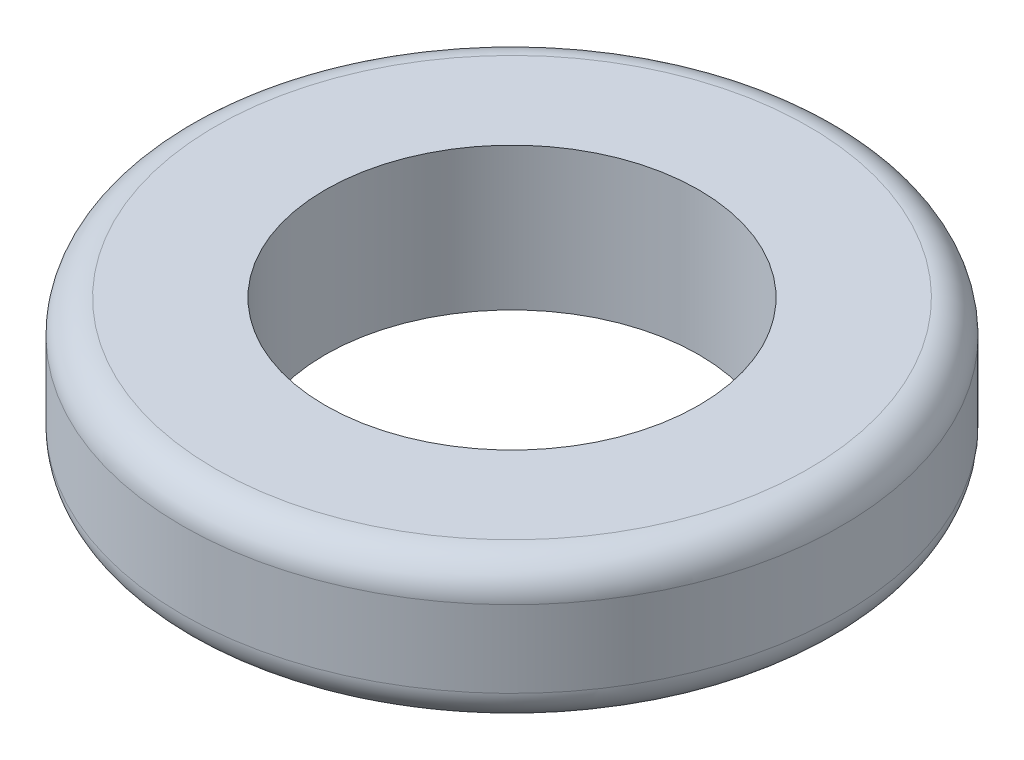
SolidWorks part; units mm, degrees
ref_plane "Front Plane" through (0, 0, 0) normal (0, 0, 1) x (1, 0, 0)
ref_plane "Top Plane" through (0, 0, 0) normal (0, 1, 0) x (1, 0, 0)
ref_plane "Right Plane" through (0, 0, 0) normal (1, 0, 0) x (0, 0, -1)
sketch "Sketch1" plane through (0, 0, 0) normal (0, 1, 0) x (1, 0, 0)
  circle A0 centre (0, 0) radius 4.318
  circle A1 centre (0, 0) radius 7.62
  dimension "D1" = 15.24
  dimension "D2" = 8.636
extrude "Boss-Extrude1" add sketch "Sketch1" along normal blind 3.3
fillet "Fillet1" radius 0.762 2 edges at (0, 0, 7.62) (0, 3.3, 7.62)
